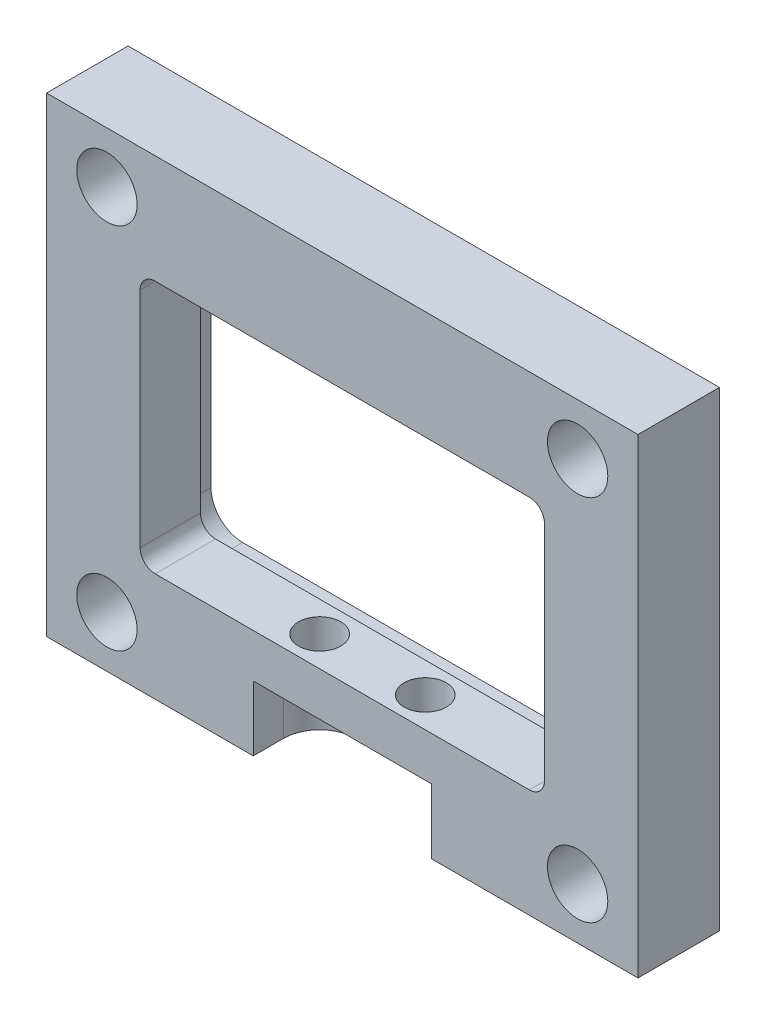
SolidWorks part; units mm, degrees
ref_plane "Plan1" through (0, 0, 0) normal (0, 0, 1) x (1, 0, 0)
ref_plane "Plan2" through (0, 0, 0) normal (0, 1, 0) x (1, 0, 0)
ref_plane "Plan3" through (0, 0, 0) normal (1, 0, 0) x (0, 0, -1)
imported_body "Importée1"
other "Empreinte1"
other "PARTIES MOULANTES<1>@MOULE156x196/BLOCEMPPARTIE FIXE<1>@PARTIES MOULANTES-"
sketch "Esquisse1" plane through (0, 0, 27) normal (0, 0, 1) x (1, 0, 0)
  line L1 (-62, 42) -> (62, 42)
  line L3 (62, -42) -> (-62, -42)
  line L5 (67, 37) -> (67, -37)
  line L7 (-67, -37) -> (-67, 37)
  arc A0 (-67, 37) -> (-62, 42) centre (-62, 37) cw
  arc A1 (-62, -42) -> (-67, -37) centre (-62, -37) cw
  arc A2 (67, -37) -> (62, -42) centre (62, -37) cw
  arc A3 (62, 42) -> (67, 37) centre (62, 37) cw
  dimension "D1" = 5
  dimension "D2" = 42
  dimension "D3" = 42
  dimension "D4" = 67
  dimension "D5" = 67
extrude "Enlèv. mat.-Extru.1" cut sketch "Esquisse1" against normal through all
sketch "Esquisse2" plane through (0, 0, 0) normal (0, 0, -1) x (-1, 0, 0)
  line L7 (-60, 45.5) -> (60, 45.5)
  line L10 (70.5, -35) -> (70.5, 35)
  line L13 (60, -45.5) -> (-60, -45.5)
  line L21 (-70.5, -35) -> (-70.5, 35)
  arc A0 (-70.5, 35) -> (-60, 45.5) centre (-60, 35) cw
  arc A1 (60, 45.5) -> (70.5, 35) centre (60, 35) cw
  arc A2 (70.5, -35) -> (60, -45.5) centre (60, -35) cw
  arc A3 (-70.5, -35) -> (-60, -45.5) centre (-60, -35) ccw
  dimension "D5" = 10.5
  dimension "D1" = 70.5
  dimension "D2" = 70.5
  dimension "D3" = 45.5
  dimension "D4" = 45.5
extrude "Enlèv. mat.-Extru.2" cut sketch "Esquisse2" against normal blind 7
sketch "Esquisse3" plane through (0, -78, -51) normal (0, 1, 0) x (1, 0, 0)
  line L1 (17.9258, -79.9924) -> (17.0793, -79.9926)
  line L2 (29.5, -68) -> (29.5, -78)
  line L3 (-29.5, -68) -> (-29.5, -78)
  line L4 (17.5, -56) -> (-17.5, -56)
  line L6 (-29.5, -78) -> (29.5, -78)
  line L7 (-98, -78) -> (98, -78) construction
  arc A0 (17.0793, -79.9926) -> (17.9258, -79.9924) centre (17.5, -68) ccw
  arc A1 (-17.5, -56) -> (-29.5, -68) centre (-17.5, -68) ccw
  arc A2 (29.5, -68) -> (17.5, -56) centre (17.5, -68) ccw
  dimension "D1" = 12
  dimension "D2" = 12
extrude "Enlèv. mat.-Extru.3" cut sketch "Esquisse3" along normal blind 21.5
other "Empreinte2"
other "PARTIES MOULANTES<1>@MOULE156x196/COUPLEUR<4>@PARTIES MOULANTES-"
other "PARTIES MOULANTES<1>@MOULE156x196/COUPLEUR<3>@PARTIES MOULANTES-"
sketch "Esquisse4" plane through (0, -56.5, 0) normal (0, -1, 0) x (1, 0, 0)
  circle A0 centre (17.5, 17) radius 7
  circle A1 centre (-17.5, 17) radius 7
  dimension "D1" = 14
  dimension "D2" = 14
extrude "Enlèv. mat.-Extru.4" cut sketch "Esquisse4" against normal blind 30
